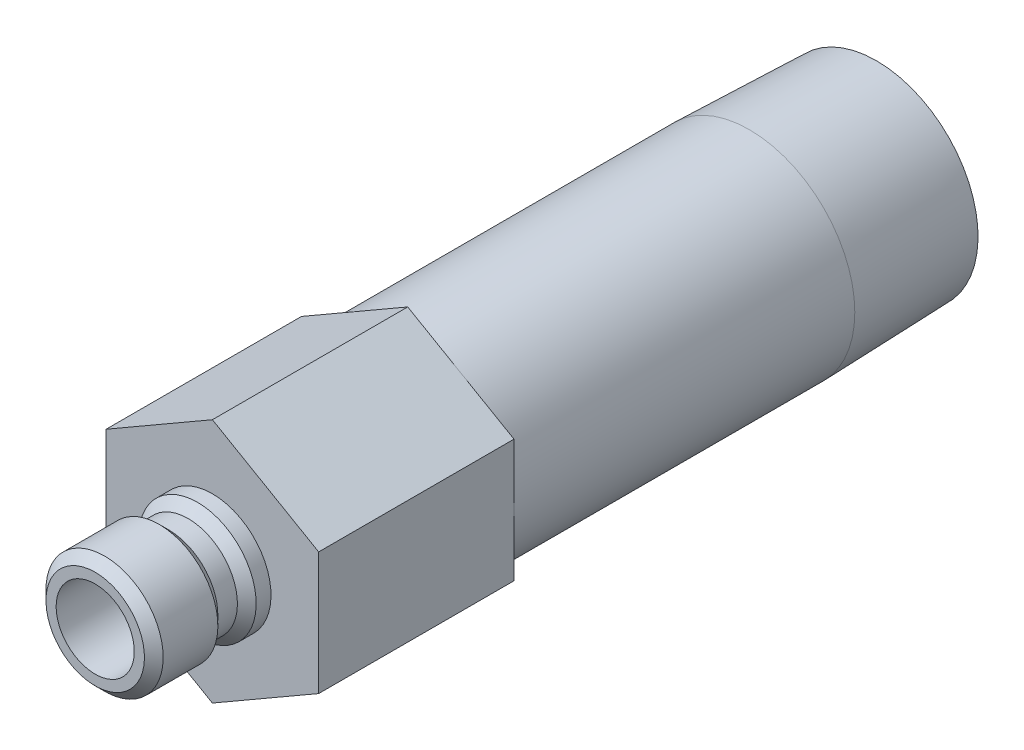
SolidWorks part; units mm, degrees
ref_plane "Front Plane" through (0, 0, 0) normal (0, 0, 1) x (1, 0, 0)
ref_plane "Top Plane" through (0, 0, 0) normal (0, 1, 0) x (1, 0, 0)
ref_plane "Right Plane" through (0, 0, 0) normal (1, 0, 0) x (0, 0, -1)
sketch "Sketch1" plane through (0, 0, 0) normal (1, 0, 0) x (0, 0, -1)
  line L0 (0, 0) -> (-12.7, 0) construction
  line L1 (-9.525, 3.175) -> (-9.525, 4.0005)
  line L2 (-3.556, 4.0005) -> (-3.556, 0) construction
  line L3 (-8.763, 4.7625) -> (-4.318, 4.7625)
  line L4 (0, 8.5725) -> (0, 0) construction
  line L5 (-3.556, 4.0005) -> (-1.9685, 4.0005)
  line L6 (-1.2065, 4.7625) -> (0, 4.7625)
  line L7 (0, 4.7625) -> (0, 8.5725)
  line L8 (-3.556, 4.0005) -> (-4.318, 4.7625)
  line L9 (-1.9685, 4.0005) -> (-1.2065, 4.7625)
  line L10 (-9.525, 4.0005) -> (-8.763, 4.7625)
  line L11 (-9.525, 3.175) -> (15.875, 3.175)
  line L12 (0, 8.5725) -> (43.6372, 8.5725)
  line L13 (43.6372, 8.5725) -> (53.975, 8.2494)
  line L14 (53.975, 8.2494) -> (53.975, 6.2611)
  line L15 (0, 0) -> (15.875, 0) construction
  line L16 (15.875, 0) -> (15.875, 3.175) construction
  line L17 (15.875, 4.7625) -> (0, 4.7625) construction
  line L18 (15.875, 3.175) -> (15.875, 6.2611)
  line L19 (15.875, 6.2611) -> (53.975, 6.2611)
  line L20 (15.875, 3.175) -> (15.875, 4.7625) construction
  dimension "D1" = 9.525
  dimension "D2" = 1.5875
  dimension "D3" = 0.762
  dimension "D4" = 45
  dimension "D5" = 5.969
  dimension "D6" = 45
  dimension "D7" = 1.79
  dimension "D8" = 10.3378
  dimension "D9" = 63.5
  dimension "D10" = 3.175
  dimension "D11" = 25.4
  dimension "D12" = 6.35
  dimension "D13" = 12.5222
  dimension "D14" = 9.525
  dimension "D15" = 17.145
revolve "Revolve1" add sketch "Sketch1" angle 360 about L0
sketch "Sketch2" plane through (0, 0, 0) normal (0, 0, 1) x (1, 0, 0)
  line L1 (-8.636, 4.986) -> (-8.636, -4.986)
  line L2 (-8.636, -4.986) -> (0, -9.972)
  line L3 (0, -9.972) -> (8.636, -4.986)
  line L4 (8.636, -4.986) -> (8.636, 4.986)
  line L5 (8.636, 4.986) -> (0, 9.972)
  line L6 (0, 9.972) -> (-8.636, 4.986)
  circle A0 centre (0, 0) radius 8.636 construction
  circle A1 centre (0, 0) radius 3.175 construction
  circle A2 centre (0, 0) radius 3.175
  dimension "D1" = 17.272
extrude "Boss-Extrude1" add sketch "Sketch2" against normal up to vertex (15.875 mm away) from vertex at 0
